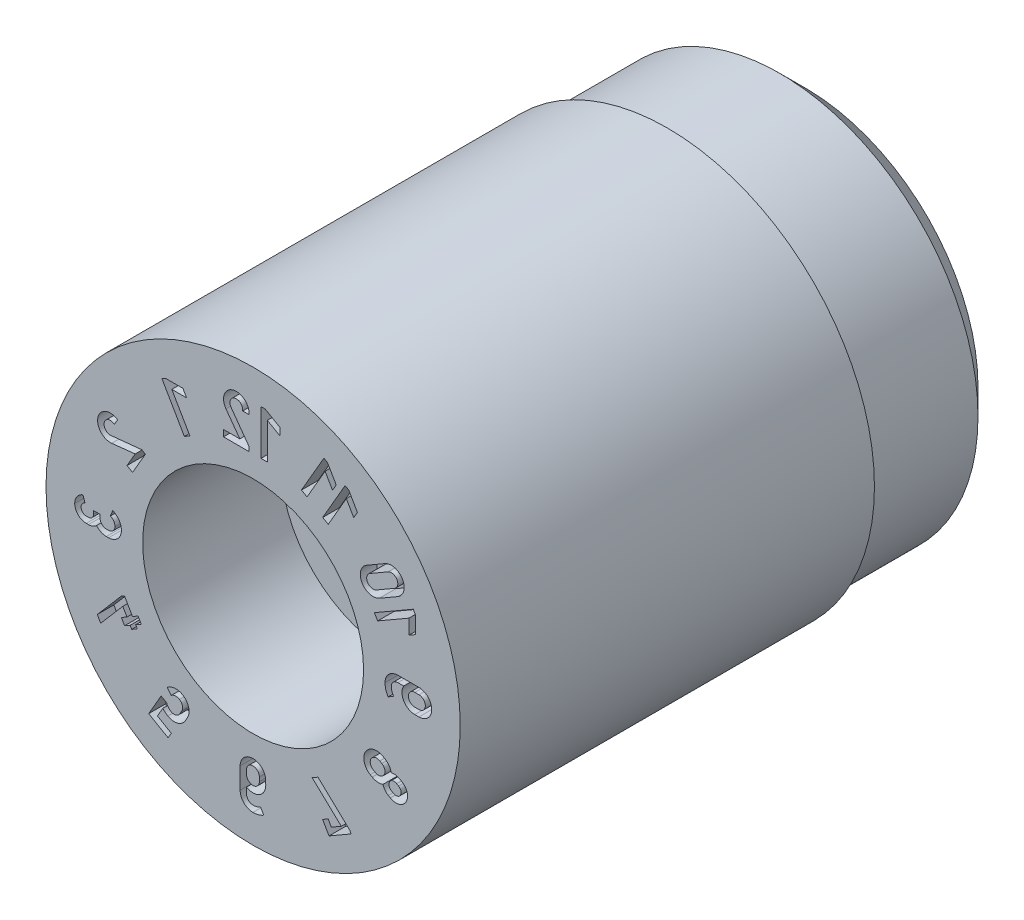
SolidWorks part; units mm, degrees
ref_plane "Front Plane" through (0, 0, 0) normal (0, 0, 1) x (1, 0, 0)
ref_plane "Top Plane" through (0, 0, 0) normal (0, 1, 0) x (1, 0, 0)
ref_plane "Right Plane" through (0, 0, 0) normal (1, 0, 0) x (0, 0, -1)
sketch "Sketch1" plane through (0, 0, 0) normal (1, 0, 0) x (0, 0, -1)
  line L2 (0, 1.5) -> (0, 0.8)
  line L3 (3.75, 1.5) -> (0, 1.5)
  line L4 (-3.7979, 0) -> (49996.2021, 0) construction
  line L8 (4, 0.5) -> (1, 0.5)
  line L9 (1, 0.8) -> (1, 0.5)
  line L10 (1, 0.8) -> (0, 0.8)
  line L12 (4, 0.5) -> (4, 1.25)
  line L16 (4, 1.25) -> (3.75, 1.5)
  dimension "D1" = 4
  dimension "D2" = 45
  dimension "D3" = 0.25
  dimension "D4" = 3
  dimension "D5" = 1.6
  dimension "D6" = 1
  dimension "D7" = 1
revolve "Revolve1" add sketch "Sketch1" angle 360 about L4
sketch "Sketch5" plane through (0, 0, 0) normal (1, 0, 0) x (0, 0, -1)
  line L0 (0, 0) -> (50000, 0) construction
  line L1 (0, 1.5) -> (0, -1.5) construction
  line L2 (3, 1.435) -> (4, 1.435)
  line L3 (3, 1.435) -> (3, 2.435)
  line L4 (3, 2.435) -> (4, 2.435)
  line L5 (4, 1.435) -> (4, 2.435)
  line L6 (4, -1.25) -> (4, 1.25) construction
  line L7 (3.75, 1.5) -> (0, 1.5) construction
  dimension "D1" = 3
  dimension "D2" = 0.065
  dimension "D3" = 1
revolve "Cut-Revolve1" cut sketch "Sketch5" angle 360 about L0
sketch "Sketch2" plane through (0, 0, 0) normal (0, 0, 1) x (1, 0, 0)
  line L0 (0.6663, 1.09) -> (0.6927, 1.0747)
  line L1 (0.6927, 1.0747) -> (0.7555, 0.9664)
  line L2 (0.7555, 0.9664) -> (0.7288, 0.9201)
  line L3 (0.7288, 0.9201) -> (0.6751, 1.0126)
  line L4 (0.6751, 1.0126) -> (0.5442, 0.7857)
  line L5 (0.5442, 0.7857) -> (0.504, 0.8089)
  line L6 (0.504, 0.8089) -> (0.6663, 1.09)
  line L7 (0.5126, 1.185) -> (0.539, 1.1698)
  line L8 (0.539, 1.1698) -> (0.6019, 1.0614)
  line L9 (0.6019, 1.0614) -> (0.5751, 1.0151)
  line L10 (0.5751, 1.0151) -> (0.5215, 1.1076)
  line L11 (0.5215, 1.1076) -> (0.3905, 0.8808)
  line L12 (0.3905, 0.8808) -> (0.3503, 0.904)
  line L13 (0.3503, 0.904) -> (0.5126, 1.185)
  line L14 (0.8921, 0.5481) -> (1.0246, 0.6246)
  line L15 (0.9782, 0.7049) -> (0.8457, 0.6284)
  line L16 (1.2011, 0.0451) -> (1.1709, 0.0451)
  line L17 (1.1709, -0.0476) -> (1.2011, -0.0476)
  line L18 (1.2011, 0.0915) -> (1.0481, 0.0915)
  line L19 (0.9772, -0.0801) -> (1.017, -0.0562)
  line L20 (1.201, -0.094) -> (1.1709, -0.0941)
  line L21 (1.0906, 0.0451) -> (1.0481, 0.0451)
  line L22 (1.0025, -0.6571) -> (1.0165, -0.6652)
  line L23 (1.0536, -0.6009) -> (1.0396, -0.5928)
  line L24 (0.4276, -0.8614) -> (0.4695, -0.8372)
  line L25 (0.4695, -0.8372) -> (0.6992, -1.0537)
  line L26 (0.6992, -1.0537) -> (0.7103, -1.0729)
  line L27 (0.7103, -1.0729) -> (0.5497, -1.1657)
  line L28 (0.5497, -1.1657) -> (0.5033, -1.0854)
  line L29 (0.5033, -1.0854) -> (0.5435, -1.0622)
  line L30 (0.5435, -1.0622) -> (0.5667, -1.1023)
  line L31 (0.5667, -1.1023) -> (0.6389, -1.0606)
  line L32 (0.6389, -1.0606) -> (0.4276, -0.8614)
  line L33 (0.8714, -0.5921) -> (0.8854, -0.6002)
  line L34 (0.9318, -0.5199) -> (0.9177, -0.5117)
  line L35 (0.955, -0.4797) -> (0.9409, -0.4716)
  line L36 (0.8482, -0.6322) -> (0.8622, -0.6403)
  line L37 (0.9793, -0.6972) -> (0.9934, -0.7053)
  line L38 (1.0768, -0.5608) -> (1.0628, -0.5526)
  line L39 (1.1598, 0.5613) -> (1.175, 0.5349)
  line L40 (1.175, 0.5349) -> (1.1752, 0.4097)
  line L41 (1.1752, 0.4097) -> (1.1289, 0.3829)
  line L42 (1.1289, 0.3829) -> (1.1287, 0.4899)
  line L43 (1.1287, 0.4899) -> (0.9019, 0.3589)
  line L44 (0.9019, 0.3589) -> (0.8787, 0.3991)
  line L45 (0.8787, 0.3991) -> (1.1598, 0.5613)
  line L46 (0.955, 0.7451) -> (0.8225, 0.6686)
  line L47 (0.9153, 0.5079) -> (1.0478, 0.5844)
  line L48 (0.0569, 1.2805) -> (0.0874, 1.2805)
  line L49 (0.0874, 1.2805) -> (0.196, 1.2181)
  line L50 (0.196, 1.2181) -> (0.196, 1.1646)
  line L51 (0.196, 1.1646) -> (0.1033, 1.2179)
  line L52 (0.1033, 1.2179) -> (0.1033, 0.9559)
  line L53 (0.1033, 0.9559) -> (0.0569, 0.9559)
  line L54 (0.0569, 0.9559) -> (0.0569, 1.2805)
  line L55 (-0.2142, 0.9552) -> (-0.0287, 0.9552)
  line L56 (-0.0287, 0.9552) -> (-0.0287, 0.9859)
  line L57 (-0.0287, 0.9859) -> (-0.1591, 1.1669)
  line L58 (-0.0756, 1.1871) -> (-0.029, 1.1871)
  line L59 (-0.1968, 1.1398) -> (-0.0959, 1.0016)
  line L60 (-0.0959, 1.0016) -> (-0.2142, 1.0016)
  line L61 (-0.2142, 1.0016) -> (-0.2142, 0.9552)
  line L62 (-0.6602, 1.0971) -> (-0.6338, 1.1124)
  line L63 (-0.6338, 1.1124) -> (-0.5085, 1.1126)
  line L64 (-0.5085, 1.1126) -> (-0.4818, 1.0663)
  line L65 (-0.4818, 1.0663) -> (-0.5887, 1.0661)
  line L66 (-0.5887, 1.0661) -> (-0.4578, 0.8392)
  line L67 (-0.4578, 0.8392) -> (-0.4979, 0.816)
  line L68 (-0.4979, 0.816) -> (-0.6602, 1.0971)
  line L69 (-0.0476, -1.0481) -> (-0.0476, -1.0782)
  line L70 (0.0451, -1.0782) -> (0.0451, -1.0481)
  line L71 (0.0915, -1.0482) -> (0.0916, -1.0782)
  line L72 (-0.0476, -1.1586) -> (-0.0476, -1.2011)
  line L73 (-0.094, -1.0481) -> (-0.094, -1.2011)
  line L74 (0.0776, -1.272) -> (0.0536, -1.2322)
  line L75 (-0.4762, -0.9377) -> (-0.4913, -0.9638)
  line L76 (-0.6662, -0.8959) -> (-0.6261, -0.9191)
  line L77 (-0.5315, -0.9407) -> (-0.5164, -0.9146)
  line L78 (-0.5932, -0.8557) -> (-0.6221, -0.8193)
  line L79 (-0.6662, -0.8959) -> (-0.7562, -1.0518)
  line L80 (-0.7562, -1.0518) -> (-0.6157, -1.133)
  line L81 (-0.6157, -1.133) -> (-0.5925, -1.0928)
  line L82 (-0.5925, -1.0928) -> (-0.6929, -1.0348)
  line L83 (-0.6929, -1.0348) -> (-0.6533, -0.9662)
  line L84 (-1.2088, -0.0845) -> (-1.1925, -0.0845)
  line L85 (-1.0627, -0.0937) -> (-1.0465, -0.0937)
  line L86 (-1.0169, 0.0917) -> (-1.0339, 0.0486)
  line L87 (-1.2323, 0.0824) -> (-1.2175, 0.0385)
  line L88 (-1.2088, -0.0381) -> (-1.1925, -0.0381)
  line L89 (-1.1554, -0.001) -> (-1.1554, 0.0222)
  line L90 (-1.1554, 0.0222) -> (-1.1091, 0.0222)
  line L91 (-1.1091, 0.0222) -> (-1.1091, -0.001)
  line L92 (-1.0627, -0.0474) -> (-1.0465, -0.0474)
  line L93 (-1.1285, -0.616) -> (-1.104, -0.6586)
  line L94 (-1.104, -0.6586) -> (-0.9438, -0.4724)
  line L95 (-0.9438, -0.4724) -> (-0.9138, -0.5244)
  line L96 (-0.9138, -0.5244) -> (-0.9539, -0.5476)
  line L97 (-0.9539, -0.5476) -> (-0.9307, -0.5877)
  line L98 (-0.9307, -0.5877) -> (-0.8906, -0.5646)
  line L99 (-0.8906, -0.5646) -> (-0.879, -0.5846)
  line L100 (-0.879, -0.5846) -> (-0.8388, -0.5615)
  line L101 (-0.8388, -0.5615) -> (-0.8504, -0.5414)
  line L102 (-0.8504, -0.5414) -> (-0.8103, -0.5182)
  line L103 (-0.8103, -0.5182) -> (-0.8335, -0.478)
  line L104 (-0.8335, -0.478) -> (-0.8736, -0.5012)
  line L105 (-0.8736, -0.5012) -> (-0.9316, -0.4008)
  line L106 (-0.9316, -0.4008) -> (-0.955, -0.4144)
  line L107 (-0.955, -0.4144) -> (-1.1285, -0.616)
  line L108 (-0.9132, 0.4259) -> (-0.873, 0.4027)
  line L109 (-0.873, 0.4027) -> (-0.7803, 0.5633)
  line L110 (-0.7803, 0.5633) -> (-0.8068, 0.5786)
  line L111 (-0.8068, 0.5786) -> (-1.0288, 0.5562)
  line L112 (-1.0045, 0.6386) -> (-0.9812, 0.679)
  line L113 (-1.0241, 0.51) -> (-0.854, 0.5283)
  line L114 (-0.854, 0.5283) -> (-0.9132, 0.4259)
  arc A0 (0.8457, 0.6284) -> (0.8921, 0.5481) centre (0.8689, 0.5882) ccw
  arc A1 (1.0246, 0.6246) -> (0.9782, 0.7049) centre (1.0014, 0.6647) ccw
  arc A2 (1.1709, 0.0451) -> (1.1709, -0.0476) centre (1.1709, -0.0013) ccw
  arc A3 (1.2011, -0.0476) -> (1.2011, 0.0451) centre (1.2011, -0.0013) ccw
  arc A4 (1.0481, 0.0915) -> (0.9553, -0.0012) centre (1.0481, -0.0013) ccw
  arc A5 (0.9553, -0.0012) -> (0.9772, -0.0801) centre (1.1082, -0.0013) ccw
  arc A6 (1.201, -0.094) -> (1.2011, 0.0915) centre (1.201, -0.0012) ccw
  arc A7 (1.0906, 0.0451) -> (1.1709, -0.0941) centre (1.1706, -0.0015) ccw
  arc A8 (1.0481, 0.0451) -> (1.0018, 0.0023) centre (1.0481, -0.0012) ccw
  arc A9 (1.0018, 0.0023) -> (1.017, -0.0562) centre (1.0946, -0.0048) ccw
  arc A10 (1.0396, -0.5928) -> (1.0025, -0.6571) centre (1.021, -0.6249) ccw
  arc A11 (1.0165, -0.6652) -> (1.0536, -0.6009) centre (1.0351, -0.633) ccw
  arc A12 (0.9177, -0.5117) -> (0.8714, -0.5921) centre (0.8946, -0.5519) ccw
  arc A13 (0.8854, -0.6002) -> (0.9318, -0.5199) centre (0.9086, -0.56) ccw
  arc A14 (1, -0.5442) -> (0.955, -0.4797) centre (0.9086, -0.56) ccw
  arc A15 (0.9409, -0.4716) -> (0.8482, -0.6322) centre (0.8945, -0.5519) ccw
  arc A16 (0.8622, -0.6403) -> (0.9406, -0.6471) centre (0.9086, -0.56) ccw
  arc A17 (0.9406, -0.6471) -> (0.9793, -0.6972) centre (1.0211, -0.6249) ccw
  arc A18 (0.9934, -0.7053) -> (1.0768, -0.5608) centre (1.0351, -0.6331) ccw
  arc A19 (1.0628, -0.5526) -> (1, -0.5442) centre (1.0211, -0.6242) ccw
  arc A20 (0.8225, 0.6686) -> (0.9153, 0.5079) centre (0.8689, 0.5882) ccw
  arc A21 (1.0478, 0.5844) -> (0.955, 0.7451) centre (1.0014, 0.6647) ccw
  arc A22 (-0.0756, 1.1871) -> (-0.1591, 1.1669) centre (-0.1215, 1.194) ccw
  arc A23 (-0.029, 1.1871) -> (-0.1968, 1.1398) centre (-0.1215, 1.194) ccw
  arc A24 (-0.0476, -1.0782) -> (0.0451, -1.0782) centre (-0.0013, -1.0782) ccw
  arc A25 (0.0451, -1.0481) -> (-0.0476, -1.0481) centre (-0.0013, -1.0481) ccw
  arc A26 (0.0915, -1.0482) -> (-0.094, -1.0481) centre (-0.0013, -1.0481) ccw
  arc A27 (-0.0476, -1.1586) -> (0.0916, -1.0782) centre (-0.001, -1.0786) ccw
  arc A28 (-0.0476, -1.2011) -> (-0.0048, -1.2473) centre (-0.0013, -1.2011) ccw
  arc A29 (-0.0048, -1.2473) -> (0.0536, -1.2322) centre (0.0023, -1.1546) ccw
  arc A30 (-0.094, -1.2011) -> (-0.0013, -1.2938) centre (-0.0012, -1.2011) ccw
  arc A31 (-0.0013, -1.2938) -> (0.0776, -1.272) centre (-0.0012, -1.141) ccw
  arc A32 (-0.618, -0.9978) -> (-0.4913, -0.9638) centre (-0.5717, -0.9173) ccw
  arc A33 (-0.6533, -0.9662) -> (-0.618, -0.9978) centre (-0.5607, -0.8981) ccw
  arc A34 (-0.4762, -0.9377) -> (-0.5102, -0.8111) centre (-0.5566, -0.8914) ccw
  arc A35 (-0.5102, -0.8111) -> (-0.6221, -0.8193) centre (-0.5601, -0.8973) ccw
  arc A36 (-0.6261, -0.9191) -> (-0.5948, -0.9576) centre (-0.56, -0.8974) ccw
  arc A37 (-0.5948, -0.9576) -> (-0.5315, -0.9407) centre (-0.5716, -0.9175) ccw
  arc A38 (-0.5164, -0.9146) -> (-0.5334, -0.8512) centre (-0.5565, -0.8914) ccw
  arc A39 (-0.5334, -0.8512) -> (-0.5932, -0.8557) centre (-0.56, -0.8975) ccw
  arc A40 (-1.2323, 0.0824) -> (-1.2922, -0.001) centre (-1.2041, -0.001) ccw
  arc A41 (-1.2922, -0.001) -> (-1.2088, -0.0845) centre (-1.2088, -0.001) ccw
  arc A42 (-1.1925, -0.0845) -> (-1.1339, -0.0604) centre (-1.1925, -0.0011) ccw
  arc A43 (-1.1339, -0.0604) -> (-1.0627, -0.0937) centre (-1.0627, -0.0011) ccw
  arc A44 (-1.0465, -0.0937) -> (-0.9538, -0.001) centre (-1.0465, -0.001) ccw
  arc A45 (-0.9538, -0.001) -> (-1.0169, 0.0917) centre (-1.0535, -0.001) ccw
  arc A46 (-1.2175, 0.0385) -> (-1.2459, -0.001) centre (-1.2042, -0.001) ccw
  arc A47 (-1.2459, -0.001) -> (-1.2088, -0.0381) centre (-1.2087, -0.001) ccw
  arc A48 (-1.1925, -0.0381) -> (-1.1554, -0.001) centre (-1.1925, -0.001) ccw
  arc A49 (-1.1091, -0.001) -> (-1.0627, -0.0474) centre (-1.0627, -0.001) ccw
  arc A50 (-1.0465, -0.0474) -> (-1.0001, -0.001) centre (-1.0465, -0.001) ccw
  arc A51 (-1.0001, -0.001) -> (-1.0339, 0.0486) centre (-1.0535, -0.001) ccw
  arc A52 (-1.0045, 0.6386) -> (-1.0288, 0.5562) centre (-1.0334, 0.6024) ccw
  arc A53 (-0.9812, 0.679) -> (-1.0241, 0.51) centre (-1.0334, 0.6023) ccw
extrude "Cut-Extrude1" cut sketch "Sketch2" against normal blind 0.12
